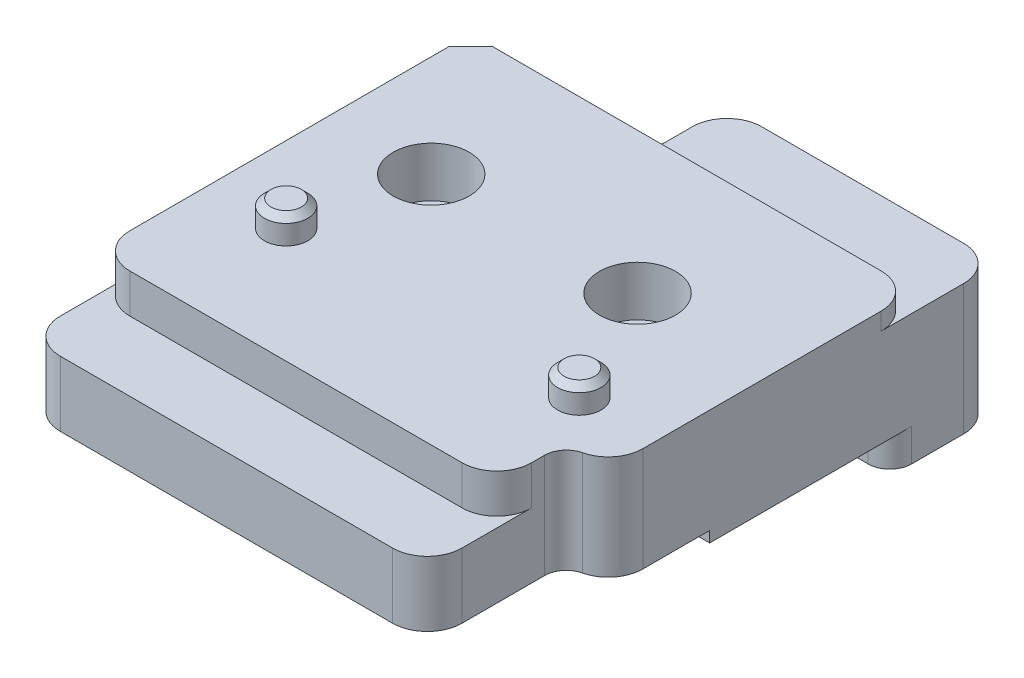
SolidWorks part; units mm, degrees
ref_plane "前视基准面" through (0, 0, 0) normal (0, 0, 1) x (1, 0, 0)
ref_plane "上视基准面" through (0, 0, 0) normal (0, 1, 0) x (1, 0, 0)
ref_plane "右视基准面" through (0, 0, 0) normal (1, 0, 0) x (0, 0, -1)
sketch "草图1" plane through (0, 0, 0) normal (0, 1, 0) x (1, 0, 0)
  line L0 (0, 0) -> (0, 11.17) construction
  line L1 (-12.75, 2.5) -> (-2.5, 2.5)
  line L2 (-12.75, 2.5) -> (-12.75, -2.5)
  line L3 (-12.75, -2.5) -> (12.75, -2.5)
  line L4 (12.75, 2.5) -> (12.75, -2.5)
  line L5 (-12.75, 2.5) -> (12.75, -2.5) construction
  line L6 (-12.75, -2.5) -> (12.75, 2.5) construction
  line L7 (2.5, 2.5) -> (12.75, 2.5)
  line L9 (-2.5, 2.5) -> (-2.5, 7)
  line L10 (-2.5, 7) -> (2.5, 7)
  line L11 (2.5, 2.5) -> (2.5, 7)
  point P0 (0, 0)
  dimension "D1" = 25.5
  dimension "D2" = 5
  dimension "D3" = 2.5
  dimension "D4" = 2.5
  dimension "D5" = 4.5
extrude "凸台-拉伸1" add sketch "草图1" along normal blind 2.5
sketch "草图3" plane through (0, 0, 0) normal (0, -1, 0) x (1, 0, 0)
  line L0 (2.5, -7) -> (-2.5, -7) construction
  line L1 (-2.5, -7) -> (-2.5, -2.5) construction
  circle A0 centre (0, -5) radius 1.15
  dimension "D1" = 2.3
  dimension "D3" = 2.5
  dimension "D2" = 2
extrude "切除-拉伸2" cut sketch "草图3" against normal through all
sketch "草图4" plane through (0, 0, 2.5) normal (0, 0, 1) x (1, 0, 0)
  line L4 (-12.75, 0) -> (12.75, 0)
  line L5 (12.75, 0) -> (12.75, 2.5)
  line L6 (12.75, 2.5) -> (-12.75, 2.5)
  line L7 (-12.75, 2.5) -> (-12.75, 0)
  line L8 (-12.75, 0) -> (12.75, 0)
  line L9 (12.75, 0) -> (12.75, 2.5)
  line L10 (12.75, 2.5) -> (-12.75, 2.5)
  line L11 (-12.75, 2.5) -> (-12.75, 0)
  dimension "D1" = 0
extrude "凸台-拉伸2" add sketch "草图4" along normal blind 16.7
sketch "草图5" plane through (0, 0, -2.5) normal (0, 0, -1) x (-1, 0, 0)
  line L0 (2.5, 2.5) -> (12.75, 2.5) construction
  line L1 (12.75, 0) -> (13.75, 0)
  line L2 (12.75, 0) -> (12.75, 2.5)
  line L3 (12.75, 2.5) -> (13.75, 2.5)
  line L4 (13.75, 0) -> (13.75, 2.5)
  line L5 (-12.75, 0) -> (-13.75, 0)
  line L6 (-12.75, 0) -> (-12.75, 2.5)
  line L7 (-12.75, 2.5) -> (-13.75, 2.5)
  line L8 (-13.75, 0) -> (-13.75, 2.5)
  line L9 (-12.75, 2.5) -> (-2.5, 2.5) construction
  dimension "D1" = 1
  dimension "D2" = 1
extrude "凸台-拉伸3" add sketch "草图5" against normal up to surface (21.7 mm away)
sketch "草图6" plane through (0, 0, 0) normal (0, -1, 0) x (1, 0, 0)
  line L1 (-13.75, -2.5) -> (-12.45, -2.5)
  line L2 (-13.75, -2.5) -> (-13.75, 1.7905)
  line L3 (-13.75, 1.7905) -> (-12.45, 1.7905)
  line L4 (-12.45, -2.5) -> (-12.45, 1.7905)
extrude "切除-拉伸3" cut sketch "草图6" against normal through all
sketch "草图7" plane through (0, 2.5, 0) normal (0, 1, 0) x (1, 0, 0)
  line L13 (13.75, 2.5) -> (2.5, 2.5)
  line L14 (2.5, 2.5) -> (2.5, 7)
  line L15 (2.5, 7) -> (-2.5, 7)
  line L16 (-2.5, 7) -> (-2.5, 2.5)
  line L17 (-2.5, 2.5) -> (-12.45, 2.5)
  line L18 (-12.45, 2.5) -> (-12.45, -1.7905)
  line L19 (-12.45, -1.7905) -> (-13.75, -1.7905)
  line L20 (-13.75, -1.7905) -> (-13.75, -19.2)
  line L21 (-13.75, -19.2) -> (13.75, -19.2)
  line L22 (13.75, -19.2) -> (13.75, 2.5)
  line L25 (13.75, 2.5) -> (2.5, 2.5)
  line L26 (2.5, 2.5) -> (2.5, 7)
  line L27 (2.5, 7) -> (-2.5, 7)
  line L28 (-2.5, 7) -> (-2.5, 2.5)
  line L29 (-2.5, 2.5) -> (-12.45, 2.5)
  line L30 (-12.45, 2.5) -> (-12.45, -1.7905)
  line L31 (-12.45, -1.7905) -> (-13.75, -1.7905)
  line L32 (-13.75, -1.7905) -> (-13.75, -19.2)
  line L33 (-13.75, -19.2) -> (13.75, -19.2)
  line L34 (13.75, -19.2) -> (13.75, 2.5)
  circle A0 centre (0, 5) radius 1.15 construction
  circle A1 centre (0, 5) radius 1.15
  dimension "D1" = 0
extrude "凸台-拉伸4" add sketch "草图7" along normal blind 2.1
sketch "草图11" plane through (0, 0, 0) normal (0, -1, 0) x (-1, 0, 0)
  line L0 (-13.75, -19.2) -> (-13.75, 2.5) construction
  line L1 (13.75, -19.2) -> (-13.75, -19.2)
  line L2 (13.75, -19.2) -> (13.75, -8.2)
  line L3 (13.75, -8.2) -> (-13.75, -8.2)
  line L4 (-13.75, -19.2) -> (-13.75, -8.2)
  dimension "D1" = 11
extrude "切除-拉伸6" cut sketch "草图11" against normal blind 2
sketch "草图12" plane through (0, 2, 0) normal (0, -1, 0) x (1, 0, 0)
  line L0 (2.6435, 10.2047) -> (-5.9829, 18.8314)
  line L1 (-6.69, 18.8314) -> (-7.6092, 17.9122)
  line L2 (-7.6092, 17.2051) -> (1.0171, 8.5784)
  line L3 (1.7242, 8.5784) -> (2.6435, 9.4976)
  line L16 (12.4735, 10.2047) -> (3.8471, 18.8314)
  line L17 (3.14, 18.8314) -> (2.2208, 17.9122)
  line L18 (2.2208, 17.2051) -> (10.8471, 8.5784)
  line L19 (11.5542, 8.5784) -> (12.4735, 9.4976)
  arc A0 (-5.9829, 18.8314) -> (-6.69, 18.8314) centre (-6.3365, 18.4779) ccw
  arc A1 (-7.6092, 17.2051) -> (-7.6092, 17.9122) centre (-7.2557, 17.5587) cw
  arc A2 (2.6435, 9.4976) -> (2.6435, 10.2047) centre (2.2899, 9.8512) ccw
  arc A3 (1.7242, 8.5784) -> (1.0171, 8.5784) centre (1.3707, 8.9319) cw
  arc A4 (3.8471, 18.8314) -> (3.14, 18.8314) centre (3.4935, 18.4779) ccw
  arc A5 (2.2208, 17.2051) -> (2.2208, 17.9122) centre (2.5743, 17.5587) cw
  arc A6 (12.4735, 9.4976) -> (12.4735, 10.2047) centre (12.1199, 9.8512) ccw
  arc A7 (11.5542, 8.5784) -> (10.8471, 8.5784) centre (11.2007, 8.9319) cw
sketch "草图13" plane through (0, 0, 0) normal (0, -1, 0) x (1, 0, 0)
  line L1 (2.5, -7) -> (-2.5, -7)
  line L2 (2.5, -7) -> (2.5, -2.5)
  line L3 (2.5, -2.5) -> (-2.5, -2.5)
  line L4 (-2.5, -7) -> (-2.5, -2.5)
extrude "切除-拉伸8" cut sketch "草图13" against normal blind 2
fillet "圆角2" radius 2 4 edges at (-2.5, 3.3, -2.5) (2.5, 3.3, -2.5) (-2.5, 3.3, -7) (2.5, 3.3, -7)
fillet "圆角3" radius 1 1 edges at (13.75, 3.3, 19.2)
sketch "草图15" plane through (0, 2, 0) normal (0, -1, 0) x (1, 0, 0)
  line L0 (13.75, 8.2) -> (13.75, 18.2) construction
  line L1 (12.75, 19.2) -> (-13.75, 19.2) construction
  circle A0 centre (11.05, 16.5) radius 1.15
  dimension "D1" = 2.3
  dimension "D2" = 2.7
  dimension "D3" = 2.7
extrude "切除-拉伸9" cut sketch "草图15" against normal through all
sketch "草图16" plane through (0, 4.6, 0) normal (0, 1, 0) x (1, 0, 0)
  line L0 (0, 5) -> (0, -20.6564) construction
  line L1 (-5, -19.2) -> (5, -19.2) construction
  line L2 (-13.75, -19.2) -> (12.75, -19.2) construction
  line L3 (-5, -17.7) -> (5, -17.7)
  line L4 (-5, -20.7) -> (5, -20.7)
  arc A0 (-5, -17.7) -> (-5, -20.7) centre (-5, -19.2) ccw
  arc A1 (5, -20.7) -> (5, -17.7) centre (5, -19.2) ccw
  point P8 (0, -19.2)
  dimension "D1" = 1.5
  dimension "D2" = 5
extrude "切除-拉伸10" cut sketch "草图16" against normal blind 1
sketch "草图18" plane through (0, 2, 0) normal (0, -1, 0) x (1, 0, 0)
  line L4 (-2.5, -4.5) -> (-2.5, -5)
  line L5 (-0.5, -7) -> (0.5, -7)
  line L6 (2.5, -5) -> (2.5, -4.5)
  line L7 (4.5, -2.5) -> (-4.5, -2.5)
  line L8 (-2.5, -4.5) -> (-2.5, -5)
  line L9 (-0.5, -7) -> (0.5, -7)
  line L10 (2.5, -5) -> (2.5, -4.5)
  line L11 (4.5, -2.5) -> (-4.5, -2.5)
  arc A4 (-2.5, -5) -> (-0.5, -7) centre (-0.5, -5) ccw
  arc A5 (0.5, -7) -> (2.5, -5) centre (0.5, -5) ccw
  arc A6 (4.5, -2.5) -> (2.5, -4.5) centre (4.5, -4.5) ccw
  arc A7 (-2.5, -4.5) -> (-4.5, -2.5) centre (-4.5, -4.5) ccw
  arc A8 (-2.5, -5) -> (-0.5, -7) centre (-0.5, -5) ccw
  arc A9 (0.5, -7) -> (2.5, -5) centre (0.5, -5) ccw
  arc A10 (4.5, -2.5) -> (2.5, -4.5) centre (4.5, -4.5) ccw
  arc A11 (-2.5, -4.5) -> (-4.5, -2.5) centre (-4.5, -4.5) ccw
  dimension "D1" = 0
extrude "切除-拉伸11" cut sketch "草图18" against normal through all
extrude "切除-拉伸12" cut sketch "草图12" against normal blind 1
sketch "草图19" plane through (0, 0, 0) normal (0, -1, 0) x (1, 0, 0)
  line L0 (13.75, -2.5) -> (-12.45, -2.5) construction
  line L1 (-13.75, 19.2) -> (-8.75, 19.2)
  line L2 (-13.75, 19.2) -> (-13.75, -2.5)
  line L3 (-13.75, -2.5) -> (-8.75, -2.5)
  line L4 (-8.75, 19.2) -> (-8.75, -2.5)
  dimension "D1" = 5
extrude "切除-拉伸13" cut sketch "草图19" against normal through all
sketch "草图24" plane through (0, 2, 0) normal (0, -1, 0) x (1, 0, 0)
  line L4 (12.75, 19.2) -> (-8.75, 19.2)
  line L5 (-8.75, 19.2) -> (-8.75, 8.2)
  line L6 (-8.75, 8.2) -> (13.75, 8.2)
  line L7 (13.75, 8.2) -> (13.75, 18.2)
  line L8 (12.75, 19.2) -> (-8.75, 19.2)
  line L9 (-8.75, 19.2) -> (-8.75, 8.2)
  line L10 (-8.75, 8.2) -> (13.75, 8.2)
  line L11 (13.75, 8.2) -> (13.75, 18.2)
  arc A3 (13.75, 18.2) -> (12.75, 19.2) centre (12.75, 18.2) ccw
  arc A5 (13.75, 18.2) -> (12.75, 19.2) centre (12.75, 18.2) ccw
  dimension "D1" = 0
extrude "切除-拉伸18" cut sketch "草图24" against normal through all
sketch "草图25" plane through (0, 0, 0) normal (0, -1, 0) x (1, 0, 0)
  line L0 (13.75, 8.2) -> (13.75, -2.5) construction
  line L1 (-8.75, 8.2) -> (13.75, 8.2)
  line L2 (-8.75, 8.2) -> (-8.75, 6.2)
  line L3 (-8.75, 6.2) -> (13.75, 6.2)
  line L4 (13.75, 8.2) -> (13.75, 6.2)
  dimension "D1" = 2
extrude "切除-拉伸19" cut sketch "草图25" against normal blind 1.5
sketch "草图31" plane through (-8.75, 0, 0) normal (-1, 0, 0) x (0, 0, 1)
  line L6 (-2.5, 0) -> (6.2, 0)
  line L7 (6.2, 0) -> (6.2, 1.5)
  line L8 (6.2, 1.5) -> (8.2, 1.5)
  line L9 (8.2, 1.5) -> (8.2, 4.6)
  line L10 (8.2, 4.6) -> (-2.5, 4.6)
  line L11 (-2.5, 4.6) -> (-2.5, 0)
  line L12 (-2.5, 0) -> (6.2, 0)
  line L13 (6.2, 0) -> (6.2, 1.5)
  line L14 (6.2, 1.5) -> (8.2, 1.5)
  line L15 (8.2, 1.5) -> (8.2, 4.6)
  line L16 (8.2, 4.6) -> (-2.5, 4.6)
  line L17 (-2.5, 4.6) -> (-2.5, 0)
  dimension "D1" = 0
extrude "切除-拉伸22" cut sketch "草图31" against normal blind 2
sketch "草图32" plane through (0, 0, 8.2) normal (0, 0, 1) x (1, 0, 0)
  line L4 (-6.75, 4.6) -> (-6.75, 1.5)
  line L5 (-6.75, 1.5) -> (13.75, 1.5)
  line L6 (13.75, 1.5) -> (13.75, 4.6)
  line L7 (13.75, 4.6) -> (-6.75, 4.6)
  line L8 (-6.75, 4.6) -> (-6.75, 1.5)
  line L9 (-6.75, 1.5) -> (13.75, 1.5)
  line L10 (13.75, 1.5) -> (13.75, 4.6)
  line L11 (13.75, 4.6) -> (-6.75, 4.6)
  dimension "D1" = 0
extrude "凸台-拉伸6" add sketch "草图32" along normal blind 10.9
sketch "草图34" plane through (0, 1.5, 0) normal (0, -1, 0) x (1, 0, 0)
  line L1 (13.75, 19.1) -> (11.75, 19.1)
  line L2 (13.75, 19.1) -> (13.75, 12.6)
  line L3 (13.75, 12.6) -> (11.75, 12.6)
  line L4 (11.75, 19.1) -> (11.75, 12.6)
  dimension "D1" = 2
  dimension "D2" = 6.5
extrude "切除-拉伸23" cut sketch "草图34" against normal through all
sketch "草图17" plane through (0, 4.6, 0) normal (0, 1, 0) x (1, 0, 0)
  line L4 (13.75, -12.6) -> (13.75, 2.5) construction
  line L7 (-6.75, -19.1) -> (-6.75, 2.5) construction
  line L8 (13.75, 2.5) -> (-6.75, 2.5) construction
  circle A0 centre (10.25, -10.5) radius 1
  circle A1 centre (-3.25, -10.5) radius 1
  dimension "D2" = 3.5
  dimension "D3" = 3.5
  dimension "D4" = 13
  dimension "D1" = 2
  dimension "D5" = 13
extrude "凸台-拉伸8" add sketch "草图17" along normal blind 1.5
sketch "草图39" plane through (0, 4.6, 0) normal (0, 1, 0) x (1, 0, 0)
  line L6 (-6.75, -19.1) -> (11.75, -19.1)
  line L7 (-6.75, -19.1) -> (11.75, -19.1)
  line L8 (11.75, -12.6) -> (13.75, -12.6)
  line L9 (11.75, -19.1) -> (11.75, -12.6)
  line L10 (13.75, -12.6) -> (13.75, 2.5)
  line L11 (11.75, -12.6) -> (13.75, -12.6)
  line L12 (13.75, 2.5) -> (-6.75, 2.5)
  line L13 (-6.75, 2.5) -> (-6.75, -19.1)
  line L16 (11.75, -19.1) -> (11.75, -12.6)
  line L17 (13.75, -12.6) -> (13.75, 2.5)
  line L19 (13.75, 2.5) -> (-6.75, 2.5)
  line L20 (-6.75, 2.5) -> (-6.75, -19.1)
  dimension "D1" = 0
extrude "凸台-拉伸9" add sketch "草图39" along normal blind 0.5
chamfer "倒角3" distance 0.3 angle 45 2 edges at (-3.25, 6.1, 11.5) (10.25, 6.1, 11.5)
sketch "草图42" plane through (0, 5.1, 0) normal (0, 1, 0) x (1, 0, 0)
  line L1 (13.75, 2.5) -> (1.25, 2.5)
  line L2 (13.75, 2.5) -> (13.75, 5.8)
  line L3 (13.75, 5.8) -> (1.25, 5.8)
  line L4 (1.25, 2.5) -> (1.25, 5.8)
  dimension "D1" = 3.3
  dimension "D2" = 12.5
extrude "凸台-拉伸10" add sketch "草图42" against normal blind 3.6
sketch "草图43" plane through (0, 1.5, 0) normal (0, -1, 0) x (1, 0, 0)
  line L0 (1.25, -5.8) -> (1.25, -2.5) construction
  line L1 (13.75, -5.8) -> (1.25, -5.8)
  line L2 (13.75, -5.8) -> (13.75, -0.3)
  line L3 (13.75, -0.3) -> (1.25, -0.3)
  line L4 (1.25, -5.8) -> (1.25, -0.3)
  dimension "D1" = 5.5
extrude "凸台-拉伸11" add sketch "草图43" along normal blind 3.4
sketch "草图44" plane through (0, 0, -0.3) normal (0, 0, 1) x (1, 0, 0)
  line L0 (13.75, -1.9) -> (1.25, -1.9) construction
  line L1 (10.3099, -1.9) -> (3.3817, -1.9) construction
  arc A0 (10.3099, -1.9) -> (3.3817, -1.9) centre (6.8458, -2.4) ccw construction
  arc A1 (10.3099, -1.9) -> (3.3817, -1.9) centre (6.8458, -2.4) ccw construction
  circle A2 centre (6.8458, -2.4) radius 3.5
  dimension "D1" = 7
extrude "切除-拉伸29" cut sketch "草图44" against normal through all
sketch "草图45" plane through (0, -1.9, 0) normal (0, -1, 0) x (1, 0, 0)
  line L0 (6.8458, -5.3) -> (6.8458, 4.2448) construction
  line L1 (3.3817, -5.8) -> (10.3099, -5.8) construction
  line L2 (3.3817, -2.55) -> (15.5121, -2.55) construction
  line L4 (6.8458, -4.05) -> (6.8458, -1.05) construction
  line L5 (6.3458, -4.05) -> (6.3458, -1.05)
  line L6 (7.3458, -4.05) -> (7.3458, -1.05)
  arc A0 (6.3458, -4.05) -> (7.3458, -4.05) centre (6.8458, -4.05) ccw
  arc A1 (7.3458, -1.05) -> (6.3458, -1.05) centre (6.8458, -1.05) ccw
  point P10 (6.8458, -2.55)
  dimension "D1" = 0.5
  dimension "D2" = 1.5
  dimension "D3" = 1.5
  dimension "D4" = 3.25
extrude "切除-拉伸30" cut sketch "草图45" against normal blind 3.4
sketch "草图46" plane through (0, 5.1, 0) normal (0, 1, 0) x (1, 0, 0)
  line L1 (1.2465, 2.5) -> (14.0985, 2.5)
  line L2 (1.2465, 2.5) -> (1.2465, 7.0964)
  line L3 (1.2465, 7.0964) -> (14.0985, 7.0964)
  line L4 (14.0985, 2.5) -> (14.0985, 7.0964)
extrude "切除-拉伸32" cut sketch "草图46" against normal blind 1
sketch "草图47" plane through (0, 1.5, 0) normal (0, -1, 0) x (1, 0, 0)
  line L5 (13.75, 6.2) -> (13.75, 12.6)
  line L6 (11.75, 12.6) -> (11.75, 19.1)
  line L7 (11.75, 19.1) -> (-6.75, 19.1)
  line L8 (-6.75, 19.1) -> (-6.75, 6.2)
  line L9 (-6.75, 6.2) -> (13.75, 6.2)
  line L10 (13.75, 6.2) -> (13.75, 12.6)
  line L11 (11.75, 12.6) -> (11.75, 19.1)
  line L12 (11.75, 19.1) -> (-6.75, 19.1)
  line L13 (-6.75, 19.1) -> (-6.75, 6.2)
  line L14 (-6.75, 6.2) -> (13.75, 6.2)
  line L16 (13.75, 12.6) -> (11.75, 12.6)
  line L17 (13.75, 12.6) -> (11.75, 12.6)
  dimension "D1" = 0
extrude "凸台-拉伸12" add sketch "草图47" along normal blind 1.9
sketch "草图49" plane through (0, -0.4, 0) normal (0, -1, 0) x (-1, 0, 0)
  line L0 (-10.3888, -9.8577) -> (-11.7926, -11.2615) construction
  line L1 (-11.7926, -11.2615) -> (-4.7221, -18.332) construction
  line L2 (-4.7221, -18.332) -> (-3.3183, -16.9282) construction
  line L3 (-3.3183, -16.9282) -> (-10.3888, -9.8577) construction
  line L4 (-1.2211, -9.152) -> (-2.0017, -9.9326) construction
  line L5 (-2.0017, -9.9326) -> (5.0788, -17.0131) construction
  line L6 (5.0788, -17.0131) -> (5.8595, -16.2325) construction
  line L7 (5.8595, -16.2325) -> (-1.2211, -9.152) construction
  line L8 (-10.3888, -9.0092) -> (-12.6411, -11.2615)
  line L9 (-12.6411, -11.2615) -> (-5.2524, -18.6502)
  line L10 (-4.1918, -18.6502) -> (-2.4698, -16.9282)
  line L11 (-2.4698, -16.9282) -> (-10.3888, -9.0092)
  line L12 (-1.2211, -8.3034) -> (-2.8503, -9.9326)
  line L13 (-2.8503, -9.9326) -> (5.0788, -17.8617)
  line L14 (5.0788, -17.8617) -> (6.708, -16.2325)
  line L15 (6.708, -16.2325) -> (-1.2211, -8.3034)
  line L16 (-12.6411, -11.2615) -> (-4.7221, -19.1806) construction
  line L17 (-4.7221, -19.1806) -> (-2.4698, -16.9282) construction
  arc A0 (-5.2524, -18.6502) -> (-4.1918, -18.6502) centre (-4.7221, -18.1199) ccw
  dimension "D2" = 0.75
  dimension "D1" = 0.6
extrude "切除-拉伸34" cut sketch "草图49" against normal blind 1
sketch "草图50" plane through (0, 0, 0) normal (0, -1, 0) x (1, 0, 0)
  line L8 (9.3934, -0.3) -> (13.75, -0.3)
  line L9 (13.75, -0.3) -> (13.75, 6.2)
  line L10 (13.75, 6.2) -> (-6.75, 6.2)
  line L11 (-6.75, 6.2) -> (-6.75, -2.5)
  line L12 (-6.75, -2.5) -> (1.25, -2.5)
  line L13 (1.25, -2.5) -> (1.25, -0.3)
  line L14 (1.25, -0.3) -> (4.2983, -0.3)
  line L15 (4.2983, -0.3) -> (9.3934, -0.3)
  line L16 (9.3934, -0.3) -> (13.75, -0.3)
  line L17 (13.75, -0.3) -> (13.75, 6.2)
  line L18 (13.75, 6.2) -> (-6.75, 6.2)
  line L19 (-6.75, 6.2) -> (-6.75, -2.5)
  line L20 (-6.75, -2.5) -> (1.25, -2.5)
  line L21 (1.25, -2.5) -> (1.25, -0.3)
  line L22 (1.25, -0.3) -> (4.2983, -0.3)
  line L23 (4.2983, -0.3) -> (9.3934, -0.3)
  dimension "D1" = 0
extrude "凸台-拉伸13" add sketch "草图50" along normal up to surface (0.4 mm away)
sketch "草图51" plane through (0, 0, -2.5) normal (0, 0, -1) x (-1, 0, 0)
  line L6 (6.75, -0.4) -> (6.75, 5.1)
  line L7 (6.75, 5.1) -> (-13.75, 5.1)
  line L8 (-13.75, 5.1) -> (-13.75, 4.1)
  line L9 (-13.75, 4.1) -> (-1.25, 4.1)
  line L10 (-1.25, 4.1) -> (-1.25, -0.4)
  line L11 (-1.25, -0.4) -> (6.75, -0.4)
  line L12 (6.75, -0.4) -> (6.75, 5.1)
  line L13 (6.75, 5.1) -> (-13.75, 5.1)
  line L14 (-13.75, 5.1) -> (-13.75, 4.1)
  line L15 (-13.75, 4.1) -> (-1.25, 4.1)
  line L16 (-1.25, 4.1) -> (-1.25, -0.4)
  line L17 (-1.25, -0.4) -> (6.75, -0.4)
  dimension "D1" = 0
extrude "切除-拉伸35" cut sketch "草图51" against normal blind 1
sketch "草图52" plane through (0, 0, -0.3) normal (0, 0, -1) x (-1, 0, 0)
  line L1 (-9.7181, -0.4) -> (-3.9736, -0.4)
  line L2 (-9.7181, -0.4) -> (-3.9736, -0.4)
  arc A1 (-3.9736, -0.4) -> (-9.7181, -0.4) centre (-6.8458, -2.4) ccw
  arc A2 (-3.9736, -0.4) -> (-9.7181, -0.4) centre (-6.8458, -2.4) ccw
  dimension "D1" = 0
extrude "切除-拉伸36" cut sketch "草图52" against normal blind 2
fillet "圆角11" radius 0.75 7 edges at (2.4698, 0.1, 16.9282) (12.6411, 0.1, 11.2615) (10.3888, 0.1, 9.0092) (2.8503, 0.1, 9.9326) (1.2211, 0.1, 8.3034) (-5.0788, 0.1, 17.8617) (-6.708, 0.1, 16.2325)
sketch "草图55" plane through (0, 0, 19.1) normal (0, 0, 1) x (1, 0, 0)
  line L4 (11.75, -0.4) -> (11.75, 5.1)
  line L5 (11.75, 5.1) -> (-6.75, 5.1)
  line L6 (-6.75, 5.1) -> (-6.75, -0.4)
  line L7 (-6.75, -0.4) -> (11.75, -0.4)
  line L8 (11.75, -0.4) -> (11.75, 5.1)
  line L9 (11.75, 5.1) -> (-6.75, 5.1)
  line L10 (-6.75, 5.1) -> (-6.75, -0.4)
  line L11 (-6.75, -0.4) -> (11.75, -0.4)
  dimension "D1" = 0
extrude "切除-拉伸39" cut sketch "草图55" against normal blind 0.1
fillet "圆角8" radius 1 2 edges at (11.75, 2.35, 12.6) (1.25, 1.85, -1.5)
hole_wizard "打孔尺寸(%根据)内六角圆柱头螺钉的类型0" positions "草图56" profile "草图57" counterbore size "M2" standard "GB"
sketch "草图56" plane through (0, -0.4, 0) normal (0, -1, 0) x (-1, 0, 0)
  point P0 (2.07, -4.9998)
  point P2 (-7.43, -4.9998)
sketch "草图57" plane through (-2.07, -0.4, 4.9998) normal (1, 0, 0) x (0, 0, -1)
  line L0 (0, 0) -> (0, 6.6609)
  line L1 (0, 6.6609) -> (1.1, 6)
  line L2 (1.1, 6) -> (1.1, 2.3)
  line L3 (1.1, 2.3) -> (2, 2.3)
  line L4 (2, 2.3) -> (2, 0)
  line L5 (2, 0) -> (0, 0)
  line L10 (0, 6.6609) -> (-1.1, 6) construction
  line L11 (0, -6.35) -> (0, 107.95) construction
  dimension "孔直径" = 2.2
  dimension "孔深度" = 6
  dimension "柱形沉头孔直径" = 4
  dimension "柱形沉头孔深度" = 2.3
  dimension "导头角度" = 118
sketch "草图58" plane through (0, 5.1, 0) normal (0, 1, 0) x (1, 0, 0)
  circle A0 centre (7.43, -4.9998) radius 1.75
  circle A1 centre (-2.07, -4.9998) radius 1.75
  dimension "D1" = 3.5
  dimension "D2" = 3.5
extrude "切除-拉伸40" cut sketch "草图58" against normal blind 2.5
sketch "草图59" plane through (0, 5.1, 0) normal (0, 1, 0) x (1, 0, 0)
  line L5 (-6.75, 1.5) -> (-6.75, -19)
  line L6 (-6.75, -19) -> (11.75, -19)
  line L7 (11.75, -19) -> (11.75, -13.6)
  line L8 (13.75, -12.6) -> (13.75, 1.5)
  line L9 (13.75, 1.5) -> (-6.75, 1.5)
  line L10 (-6.75, 1.5) -> (-6.75, -19)
  line L11 (-6.75, -19) -> (11.75, -19)
  line L12 (11.75, -19) -> (11.75, -13.6)
  line L13 (13.75, -12.6) -> (13.75, 1.5)
  line L14 (13.75, 1.5) -> (-6.75, 1.5)
  line L16 (12.75, -12.6) -> (13.75, -12.6)
  line L17 (12.75, -12.6) -> (13.75, -12.6)
  circle A0 centre (-3.25, -10.5) radius 1 construction
  circle A1 centre (10.25, -10.5) radius 1 construction
  circle A2 centre (-3.25, -10.5) radius 1
  circle A3 centre (10.25, -10.5) radius 1
  arc A7 (12.75, -12.6) -> (11.75, -13.6) centre (12.75, -13.6) ccw
  arc A12 (12.75, -12.6) -> (11.75, -13.6) centre (12.75, -13.6) ccw
  dimension "D1" = 0
extrude "切除-拉伸41" cut sketch "草图59" against normal blind 0.2
sketch "草图60" plane through (0, 0, -5.8) normal (0, 0, -1) x (-1, 0, 0)
  line L5 (-1.25, 4.1) -> (-13.75, 4.1)
  line L6 (-13.75, 4.1) -> (-13.75, -1.9)
  line L7 (-13.75, -1.9) -> (-10.3099, -1.9)
  line L8 (-3.3817, -1.9) -> (-1.25, -1.9)
  line L9 (-1.25, -1.9) -> (-1.25, 4.1)
  line L10 (-1.25, 4.1) -> (-13.75, 4.1)
  line L11 (-13.75, 4.1) -> (-13.75, -1.9)
  line L12 (-13.75, -1.9) -> (-10.3099, -1.9)
  line L13 (-3.3817, -1.9) -> (-1.25, -1.9)
  line L14 (-1.25, -1.9) -> (-1.25, 4.1)
  arc A1 (-3.3817, -1.9) -> (-10.3099, -1.9) centre (-6.8458, -2.4) ccw
  arc A2 (-3.3817, -1.9) -> (-10.3099, -1.9) centre (-6.8458, -2.4) ccw
  dimension "D1" = 0
extrude "切除-拉伸42" cut sketch "草图60" against normal blind 0.5
fillet "圆角10" radius 1 2 edges at (13.75, -1.15, -0.3) (1.25, -1.15, -0.3)
sketch "草图61" plane through (0, -0.4, 0) normal (0, -1, 0) x (1, 0, 0)
  line L0 (13.75, -1.3) -> (13.75, 12.6) construction
  line L1 (13.75, 8) -> (-6.9757, 8)
  line L2 (13.75, 8) -> (13.75, 19.0325)
  line L3 (13.75, 19.0325) -> (-6.9757, 19.0325)
  line L4 (-6.9757, 8) -> (-6.9757, 19.0325)
  line L5 (-6.75, 19) -> (11.75, 19) construction
  dimension "D1" = 11
extrude "切除-拉伸43" cut sketch "草图61" against normal blind 1
sketch "草图62" plane through (0, 0.6, 0) normal (0, -1, 0) x (1, 0, 0)
  line L5 (11.75, 13.6) -> (11.75, 19)
  line L6 (11.75, 19) -> (-6.75, 19)
  line L7 (-6.75, 19) -> (-6.75, 8)
  line L8 (-6.75, 8) -> (13.75, 8)
  line L9 (13.75, 8) -> (13.75, 12.6)
  line L10 (11.75, 13.6) -> (11.75, 19)
  line L11 (11.75, 19) -> (-6.75, 19)
  line L12 (-6.75, 19) -> (-6.75, 8)
  line L13 (-6.75, 8) -> (13.75, 8)
  line L14 (13.75, 8) -> (13.75, 12.6)
  line L16 (13.75, 12.6) -> (12.75, 12.6)
  line L17 (13.75, 12.6) -> (12.75, 12.6)
  arc A4 (11.75, 13.6) -> (12.75, 12.6) centre (12.75, 13.6) ccw
  arc A8 (11.75, 13.6) -> (12.75, 12.6) centre (12.75, 13.6) ccw
  dimension "D1" = 0
extrude "凸台-拉伸14" add sketch "草图62" along normal blind 0.5
sketch "草图63" plane through (0, 0.1, 0) normal (0, -1, 0) x (1, 0, 0)
  line L0 (11.8029, 11.2705) -> (4.7319, 18.3415) construction
  line L1 (4.7319, 18.3415) -> (3.3177, 16.9273) construction
  line L2 (3.3177, 16.9273) -> (10.3887, 9.8563) construction
  line L3 (10.3887, 9.8563) -> (11.8029, 11.2705) construction
  line L4 (1.2269, 9.1515) -> (2.0048, 9.9293) construction
  line L5 (2.0048, 9.9293) -> (-5.0663, 17.0004) construction
  line L6 (-5.0663, 17.0004) -> (-5.8441, 16.2225) construction
  line L7 (-5.8441, 16.2225) -> (1.2269, 9.1515) construction
  line L8 (13.25, 11.5912) -> (12.5998, 12.2414)
  line L9 (3.1226, 18.5) -> (1.5499, 16.9273)
  line L10 (1.5499, 16.9273) -> (10.1772, 8.3)
  line L11 (10.6002, 8.3) -> (13.25, 10.9498)
  line L12 (2.1432, 8.3) -> (3.7725, 9.9293)
  line L13 (3.7725, 9.9293) -> (-4.7982, 18.5)
  line L14 (-5.3344, 18.5) -> (-6.25, 17.5844)
  line L15 (-6.25, 14.8606) -> (0.3106, 8.3)
  line L16 (6.3412, 18.5) -> (3.1226, 18.5)
  line L17 (11.75, 19) -> (-6.75, 19) construction
  line L18 (2.1432, 8.3) -> (0.3106, 8.3)
  line L19 (4.7319, 20.1093) -> (1.5499, 16.9273) construction
  line L20 (13.5707, 11.2705) -> (4.7319, 20.1093) construction
  line L21 (-6.25, 14.8606) -> (-6.25, 17.5844)
  line L22 (-6.75, 8) -> (13.75, 8) construction
  line L23 (-6.75, 19) -> (-6.75, 8) construction
  line L24 (1.2269, 7.3837) -> (3.7725, 9.9293) construction
  line L25 (-7.6119, 16.2225) -> (1.2269, 7.3837) construction
  line L26 (-5.0663, 18.7681) -> (-7.6119, 16.2225) construction
  line L27 (-4.7982, 18.5) -> (-5.3344, 18.5)
  line L28 (3.7725, 9.9293) -> (-5.0663, 18.7681) construction
  line L29 (10.1772, 8.3) -> (10.6002, 8.3)
  line L30 (13.25, 10.9498) -> (13.25, 11.5912)
  line L31 (13.75, 8) -> (13.75, 12.6) construction
  line L32 (1.5499, 16.9273) -> (10.3887, 8.0885) construction
  line L33 (10.3887, 8.0885) -> (13.5707, 11.2705) construction
  line L34 (11.3914, 13.4498) -> (6.3412, 18.5)
  arc A0 (11.3914, 13.4498) -> (12.5998, 12.2414) centre (12.75, 13.6) ccw
  dimension "D2" = 0.5
  dimension "D3" = 0.3
  dimension "D4" = 0.5
  dimension "D5" = 0.5
  dimension "D1" = 1.25
extrude "切除-拉伸44" [suppressed] cut sketch "草图63" against normal blind 0.1
sketch "草图64" plane through (0, 0, 1.7) normal (0, 0, -1) x (-1, 0, 0)
  line L1 (-9.7181, -0.4) -> (-3.9736, -0.4)
  line L2 (-9.7181, -0.4) -> (-3.9736, -0.4)
  arc A1 (-3.9736, -0.4) -> (-9.7181, -0.4) centre (-6.8458, -2.4) ccw
  arc A2 (-3.9736, -0.4) -> (-9.7181, -0.4) centre (-6.8458, -2.4) ccw
  dimension "D1" = 0
extrude "凸台-拉伸15" add sketch "草图64" along normal blind 2
sketch "草图65" plane through (0, 4.9, 0) normal (0, 1, 0) x (1, 0, 0)
  line L0 (-6.75, 1.5) -> (-6.75, -19) construction
  line L1 (-6.75, -15.8) -> (11.75, -15.8)
  line L2 (-6.75, -15.8) -> (-6.75, -19.7971)
  line L3 (-6.75, -19.7971) -> (11.75, -19.7971)
  line L4 (11.75, -15.8) -> (11.75, -19.7971)
  line L5 (-6.75, -19) -> (11.75, -19) construction
  line L6 (11.75, -19) -> (11.75, -13.6) construction
  dimension "D1" = 3.2
extrude "切除-拉伸45" cut sketch "草图65" against normal blind 1.8
fillet "圆角13" radius 1.6 8 edges at (13.75, 1.1, -5.3) (1.25, 1.1, -5.3) (-6.75, 1.6, 19) (11.75, 1.6, 19) (13.75, 2.5, 12.6) (11.75, 4, 15.8) (-6.75, 4, 15.8) (13.75, 4.5, -1.5)
chamfer "倒角4" distance 1 angle 45 1 edges at (-6.75, 2.25, -1.5)
